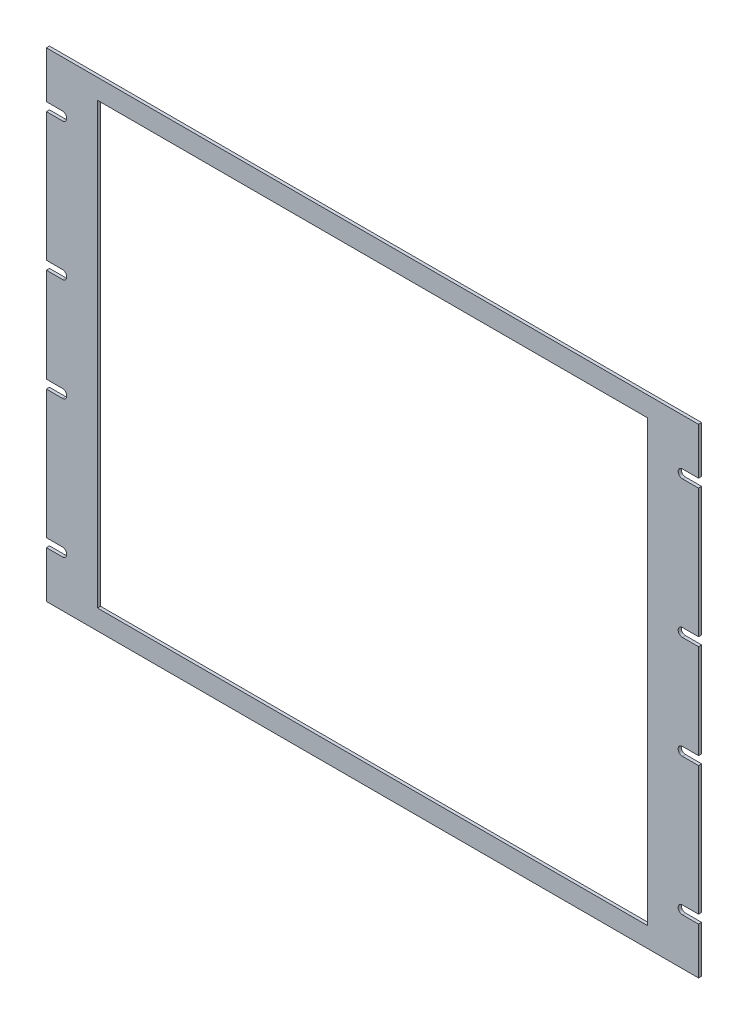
SolidWorks part; units mm, degrees
ref_plane "Front Plane" through (0, 0, 0) normal (0, 0, 1) x (1, 0, 0)
ref_plane "Top Plane" through (0, 0, 0) normal (0, 1, 0) x (1, 0, 0)
ref_plane "Right Plane" through (0, 0, 0) normal (1, 0, 0) x (0, 0, -1)
sketch "Model" plane through (0, 0, 0) normal (0, 0, 1) x (1, 0, 0)
  line L0 (241.3, -177.3936) -> (-241.3, -177.3936)
  line L1 (-241.3, 177.419) -> (-241.3, 142.875)
  line L2 (241.3, 177.419) -> (241.3, 142.875)
  line L3 (241.3, 177.419) -> (-241.3, 177.419)
  line L4 (203.454, -162.687) -> (-203.454, -162.687)
  line L5 (203.454, 162.687) -> (-203.454, 162.687)
  line L6 (-203.454, 162.687) -> (-203.454, -162.687)
  line L7 (203.454, 162.687) -> (203.454, -162.687)
  line L8 (241.3, 142.875) -> (229.3874, 142.875)
  line L9 (241.3, 136.525) -> (229.3874, 136.525)
  line L10 (241.3, 41.275) -> (229.3874, 41.275)
  line L11 (241.3, 34.925) -> (229.3874, 34.925)
  line L12 (241.3, -34.925) -> (229.3874, -34.925)
  line L13 (241.3, -41.275) -> (229.3874, -41.275)
  line L14 (241.3, -136.525) -> (229.3874, -136.525)
  line L15 (241.3, -142.875) -> (229.3874, -142.875)
  line L16 (-241.3, 142.875) -> (-229.3874, 142.875)
  line L17 (-241.3, 41.275) -> (-229.3874, 41.275)
  line L18 (-241.3, 136.525) -> (-229.3874, 136.525)
  line L19 (-241.3, 34.925) -> (-229.3874, 34.925)
  line L20 (-241.3, -34.925) -> (-229.3874, -34.925)
  line L21 (-241.3, -41.275) -> (-229.3874, -41.275)
  line L22 (-241.3, -136.525) -> (-229.3874, -136.525)
  line L23 (-241.3, -142.875) -> (-229.3874, -142.875)
  line L24 (241.3, -177.3936) -> (241.3, -142.875)
  line L25 (241.3, -136.525) -> (241.3, -41.275)
  line L26 (241.3, -34.925) -> (241.3, 34.925)
  line L27 (241.3, 41.275) -> (241.3, 136.525)
  line L28 (-241.3, -177.3936) -> (-241.3, -142.875)
  line L29 (-241.3, 136.525) -> (-241.3, 41.275)
  line L30 (-241.3, 34.925) -> (-241.3, -34.925)
  line L31 (-241.3, -41.275) -> (-241.3, -136.525)
  arc A0 (229.3874, 142.875) -> (229.3874, 136.525) centre (229.3874, 139.7) ccw
  arc A1 (229.3874, 41.275) -> (229.3874, 34.925) centre (229.3874, 38.1) ccw
  arc A2 (229.3874, -34.925) -> (229.3874, -41.275) centre (229.3874, -38.1) ccw
  arc A3 (229.3874, -136.525) -> (229.3874, -142.875) centre (229.3874, -139.7) ccw
  arc A4 (-229.3874, -142.875) -> (-229.3874, -136.525) centre (-229.3874, -139.7) ccw
  arc A5 (-229.3874, -41.275) -> (-229.3874, -34.925) centre (-229.3874, -38.1) ccw
  arc A6 (-229.3874, 34.925) -> (-229.3874, 41.275) centre (-229.3874, 38.1) ccw
  arc A7 (-229.3874, 136.525) -> (-229.3874, 142.875) centre (-229.3874, 139.7) ccw
  point P48 (-241.3, 177.419)
  point P49 (241.3, 177.419)
  point P50 (241.3, 177.419)
  point P51 (203.454, -162.687)
  point P52 (203.454, 162.687)
  point P53 (-203.454, 162.687)
  point P54 (203.454, 162.687)
  point P55 (241.3, 142.875)
  point P56 (241.3, 136.525)
  point P57 (241.3, 41.275)
  point P58 (241.3, 34.925)
  point P59 (241.3, -34.925)
  point P60 (241.3, -41.275)
  point P61 (241.3, -136.525)
  point P62 (241.3, -142.875)
  point P63 (-241.3, 142.875)
  point P64 (-241.3, 41.275)
  point P65 (-241.3, 136.525)
  point P66 (-241.3, 34.925)
  point P67 (-241.3, -34.925)
  point P68 (-241.3, -41.275)
  point P69 (-241.3, -136.525)
  point P70 (-241.3, -142.875)
  point P71 (241.3, -177.3936)
  point P72 (241.3, -136.525)
  point P73 (241.3, -34.925)
  point P74 (241.3, 41.275)
  point P75 (-241.3, -177.3936)
  point P76 (-241.3, 136.525)
  point P77 (-241.3, 34.925)
  point P78 (-241.3, -41.275)
  point P79 (-241.3, -177.3936)
  point P80 (-241.3, -177.3936)
  point P81 (-241.3, -177.3936)
  point P82 (-241.3, -177.3936)
  point P83 (-241.3, -177.3936)
  point P84 (-241.3, -177.3936)
  point P85 (-241.3, -177.3936)
  point P86 (-241.3, -177.3936)
  point P87 (-241.3, -177.3936)
  point P88 (-241.3, -177.3936)
  point P89 (-241.3, -177.3936)
  point P90 (-241.3, -177.3936)
  point P91 (-241.3, -177.3936)
  point P92 (-241.3, -177.3936)
  point P93 (-241.3, -177.3936)
  point P94 (-241.3, -177.3936)
  point P95 (-241.3, -177.3936)
  point P96 (-241.3, -177.3936)
  point P97 (-241.3, -177.3936)
  point P98 (-241.3, -177.3936)
  point P99 (-241.3, -177.3936)
  point P100 (-241.3, -177.3936)
  point P101 (-241.3, -177.3936)
  point P102 (-241.3, -177.3936)
  point P103 (-241.3, -177.3936)
  point P104 (-241.3, -177.3936)
  point P105 (-241.3, -177.3936)
  point P106 (-241.3, -177.3936)
  point P107 (-241.3, -177.3936)
  point P108 (-241.3, -177.3936)
  point P109 (-241.3, -177.3936)
  point P110 (-241.3, -177.3936)
  point P111 (-241.3, -177.3936)
  point P112 (-241.3, -177.3936)
  point P113 (-241.3, -177.3936)
  point P114 (-241.3, -177.3936)
  point P115 (-241.3, -177.3936)
  point P116 (-241.3, -177.3936)
  point P117 (-241.3, -177.3936)
  point P118 (-241.3, -177.3936)
  point P119 (-241.3, -177.3936)
  point P120 (-241.3, -177.3936)
  point P121 (-241.3, -177.3936)
  point P122 (-241.3, -177.3936)
extrude "Boss-Extrude1" add sketch "Model" along normal blind 2.286
